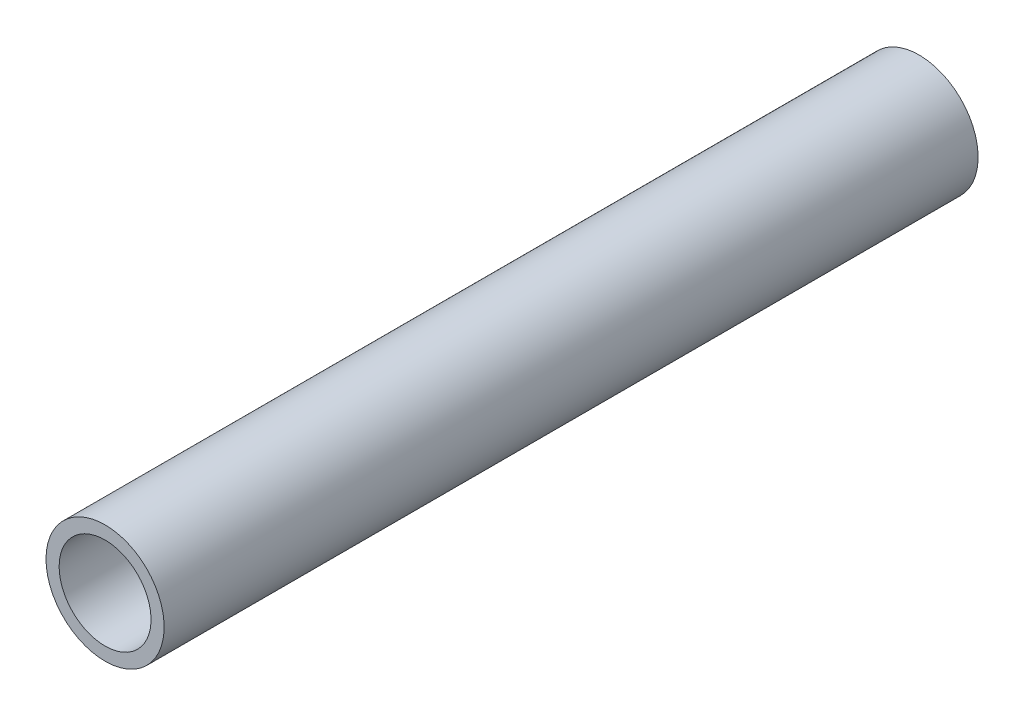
SolidWorks part; units mm, degrees
ref_plane "Face" through (0, 0, 0) normal (0, 0, 1) x (1, 0, 0)
ref_plane "Dessus" through (0, 0, 0) normal (0, 1, 0) x (1, 0, 0)
ref_plane "Droite" through (0, 0, 0) normal (1, 0, 0) x (0, 0, -1)
sketch "Esquisse1" plane through (0, 0, 0) normal (0, 0, 1) x (1, 0, 0)
  circle A0 centre (0, 0) radius 10.5
  dimension "D1" = 21
extrude "Extru.-Mince1" add sketch "Esquisse1" along normal blind 186 thin
